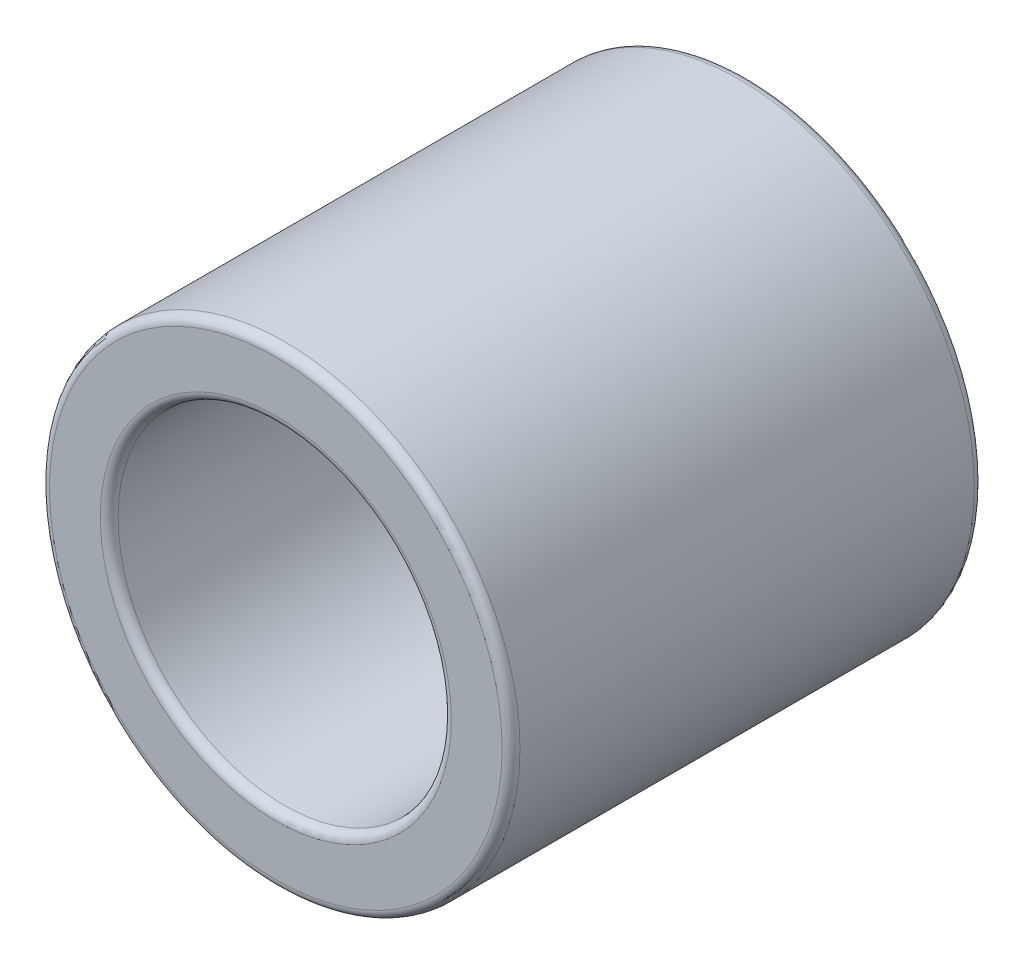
SolidWorks part; units mm, degrees
ref_plane "Front Plane" through (0, 0, 0) normal (0, 0, 1) x (1, 0, 0)
ref_plane "Top Plane" through (0, 0, 0) normal (0, 1, 0) x (1, 0, 0)
ref_plane "Right Plane" through (0, 0, 0) normal (1, 0, 0) x (0, 0, -1)
sketch "Sketch1" plane through (0, 0, 0) normal (0, 0, 1) x (1, 0, 0)
  circle A0 centre (0, 0) radius 2.3749
  circle A1 centre (0, 0) radius 3.3528
  dimension "D1" = 4.7498
  dimension "D2" = 6.7056
extrude "Boss-Extrude1" add sketch "Sketch1" along normal mid plane 6.731
fillet "Fillet1" radius 0.127 4 edges at (3.3528, 0, -3.3655) (3.3528, 0, 3.3655) (2.3749, 0, -3.3655) (2.3749, 0, 3.3655)
